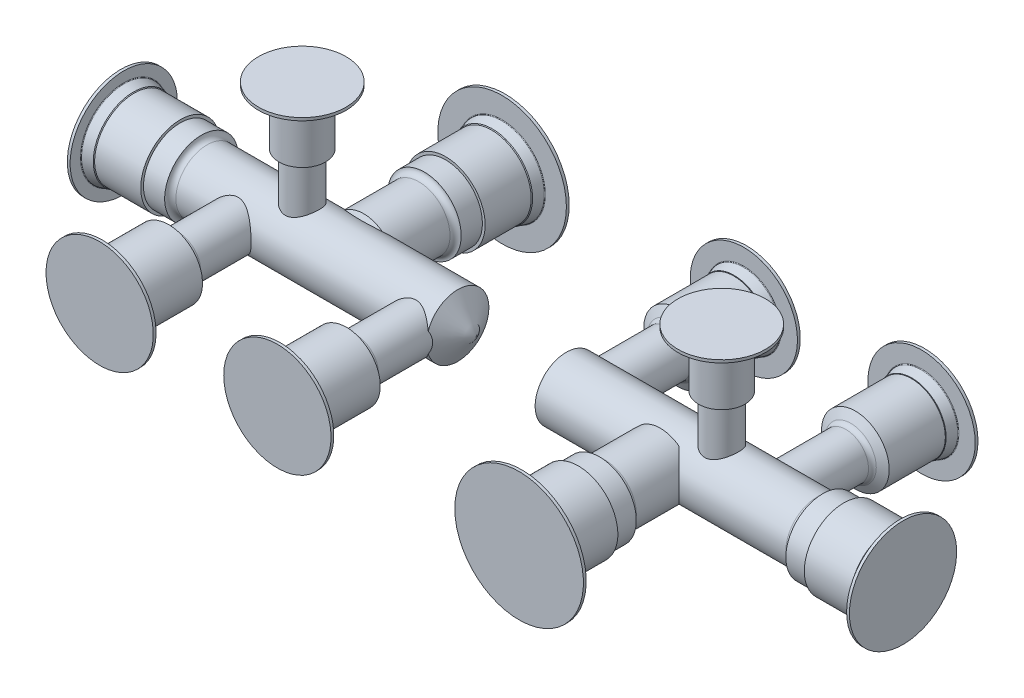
SolidWorks part; units mm, degrees
ref_plane "Front Plane" through (0, 0, 0) normal (0, 0, 1) x (1, 0, 0)
ref_plane "Top Plane" through (0, 0, 0) normal (0, 1, 0) x (1, 0, 0)
ref_plane "Right Plane" through (0, 0, 0) normal (1, 0, 0) x (0, 0, -1)
sketch "Sketch1" plane through (0, 0, 0) normal (0, 1, 0) x (1, 0, 0)
  line L0 (100, 0) -> (94.7347, -8.763)
  line L1 (0.7874, -15.0876) -> (0, -15.0876)
  line L2 (3.7131, -11.1125) -> (16.6624, -11.1125)
  line L3 (22.6314, -10.3378) -> (16.6624, -10.3378)
  line L4 (94.7347, -8.763) -> (24.2062, -8.763)
  line L5 (100, 0) -> (0, 0)
  line L6 (3.5179, -11.3077) -> (0.9286, -12.0015)
  line L7 (100, 0) -> (0, 0) construction
  line L8 (3.7131, -11.1125) -> (3.5179, -11.3077)
  line L9 (16.6624, -10.3378) -> (16.6624, -11.1125)
  line L10 (0.7874, -12.1855) -> (0.7874, -15.0876)
  line L11 (0, 0) -> (0, -15.0876)
  arc A0 (24.2062, -8.763) -> (22.6314, -10.3378) centre (24.2062, -10.3378) ccw
  arc A1 (0.9286, -12.0015) -> (0.7874, -12.1855) centre (0.9779, -12.1855) ccw
  point P8 (0.7874, -12.0393)
  dimension "D2" = 24.0787
  dimension "D4" = 0.1905
  dimension "D3" = 0.7874
  dimension "D5" = 17.526
  dimension "D6" = 3.5179
  dimension "D7" = 3.7131
  dimension "D8" = 16.6624
  dimension "D9" = 22.6314
  dimension "D10" = 59
  dimension "D11" = 100
  dimension "D12" = 20.6756
  dimension "D13" = 22.225
  dimension "D14" = 22.6154
  dimension "D15" = 30.1752
revolve "Revolve1" add sketch "Sketch1" angle 360 about L7
sketch "Sketch2" plane through (0, 0, 0) normal (0, 1, 0) x (1, 0, 0)
  line L0 (54.0876, -44.2126) -> (54.0876, -45)
  line L1 (48.525, -41.3758) -> (48.525, -25.585)
  line L3 (39, 0) -> (45.3754, -3.8307)
  line L4 (45.3754, -3.8307) -> (45.3754, -22.9115)
  line L5 (48.6313, -41.4821) -> (49.3251, -44.0714)
  line L6 (39, 0) -> (39, -45) construction
  line L7 (46.1867, -24.2889) -> (48.525, -25.585)
  line L8 (48.525, -41.3758) -> (48.6313, -41.4821)
  line L9 (0, 0) -> (100, 0) construction
  line L10 (49.5091, -44.2126) -> (54.0876, -44.2126)
  line L11 (39, -45) -> (54.0876, -45)
  line L12 (0, 15.0876) -> (0, -15.0876) construction
  line L13 (94.7347, -8.763) -> (100, 0) construction
  line L14 (39, 0) -> (39, -45)
  arc A0 (45.3754, -22.9115) -> (46.1867, -24.2889) centre (46.9502, -22.9115) ccw
  arc A1 (49.3251, -44.0714) -> (49.5091, -44.2126) centre (49.5091, -44.0221) ccw
  dimension "D1" = 1.5748
  dimension "D2" = 0.1905
  dimension "D3" = 12.7508
  dimension "D4" = 14.3734
  dimension "D5" = 0.7874
  dimension "D6" = 19.415
  dimension "D7" = 19.2626
  dimension "D8" = 20.6502
  dimension "D9" = 21.0182
  dimension "D10" = 30.1752
  dimension "D11" = 39
  dimension "D12" = 45
  dimension "D13" = 3.6242
  dimension "D14" = 59
revolve "Revolve2" add sketch "Sketch2" angle 360 about L14
pattern_linear "LPattern1" count 2 spacing 50 along (1, 0, 0) of "Revolve2"
sketch "Sketch3" plane through (0, 0, 0) normal (0, 1, 0) x (1, 0, 0)
  line L0 (63, 0) -> (54.237, 5.2653)
  line L1 (44.91, 44.2126) -> (44.91, 45)
  line L2 (51.8875, 41.2869) -> (51.8875, 28.3376)
  line L3 (52.6622, 22.3686) -> (52.6622, 28.3376)
  line L4 (54.237, 5.2653) -> (54.237, 20.7938)
  line L6 (51.6923, 41.4821) -> (50.9985, 44.0714)
  line L7 (63, 0) -> (63, 45) construction
  line L8 (51.8875, 41.2869) -> (51.6923, 41.4821)
  line L9 (52.6622, 28.3376) -> (51.8875, 28.3376)
  line L10 (50.8145, 44.2126) -> (44.91, 44.2126)
  line L11 (63, 45) -> (44.91, 45)
  line L12 (0, 0) -> (100, 0) construction
  line L13 (0, 15.0876) -> (0, -15.0876) construction
  line L14 (63, 0) -> (63, 45)
  arc A0 (54.237, 20.7938) -> (52.6622, 22.3686) centre (52.6622, 20.7938) ccw
  arc A1 (50.9985, 44.0714) -> (50.8145, 44.2126) centre (50.8145, 44.0221) ccw
  point P10 (50.9607, 44.2126)
  dimension "D1" = 1.5748
  dimension "D2" = 0.1905
  dimension "D3" = 17.526
  dimension "D4" = 20.6756
  dimension "D5" = 22.225
  dimension "D6" = 36.18
  dimension "D7" = 24.0787
  dimension "D8" = 63
  dimension "D9" = 0.7874
  dimension "D10" = 3.5179
  dimension "D11" = 59
  dimension "D12" = 45
  dimension "D13" = 3.7131
  dimension "D14" = 16.6624
  dimension "D15" = 22.6314
  dimension "D16" = 22.6154
revolve "Revolve3" add sketch "Sketch3" angle 360 about L14
ref_plane "Plane1" through (110, 0, 0) normal (1, 0, 0) x (0, 0, -1)
mirror "Mirror2" about plane through (110, 0, 0) normal (1, 0, 0)
move or copy body "Body-Move/Copy1" bodies to move or copy 106 copy no rotation origin (0, 0, 0) rotation axis (1, 0, 0) rotation angle 180
sketch "Sketch4" plane through (0, 0, 0) normal (0, 0, 1) x (1, 0, 0)
  line L0 (51, 0) -> (51, 37.5) construction
  line L2 (0, 0) -> (100, 0) construction
  line L3 (51, 0) -> (55.7625, 2.8616)
  line L4 (51, 0) -> (51, 37.5)
  line L7 (55.7625, 2.8616) -> (55.7625, 21.2414)
  line L11 (57.5405, 21.2414) -> (55.7625, 21.2414)
  line L15 (57.5405, 21.2414) -> (57.5405, 33.3054)
  line L19 (57.5405, 33.3054) -> (58.2908, 34.0557)
  line L23 (63.319, 36.71) -> (58.8549, 36.71)
  line L27 (58.2908, 34.0557) -> (58.8549, 36.71)
  line L31 (63.319, 36.71) -> (63.319, 37.5)
  line L33 (51, 37.5) -> (63.319, 37.5)
  dimension "D2" = 51
  dimension "D3" = 9.525
  dimension "D4" = 13.081
  dimension "D5" = 14.5815
  dimension "D6" = 0.79
  dimension "D7" = 3.4443
  dimension "D8" = 4.1946
  dimension "D9" = 16.2586
  dimension "D10" = 59
  dimension "D11" = 37.5
  dimension "D12" = 15.7099
  dimension "D13" = 24.638
revolve "Revolve4" add sketch "Sketch4" angle 360 about L4
pattern_linear "LPattern2" count 2 spacing 118 along (1, 0, 0) of "Revolve4"
